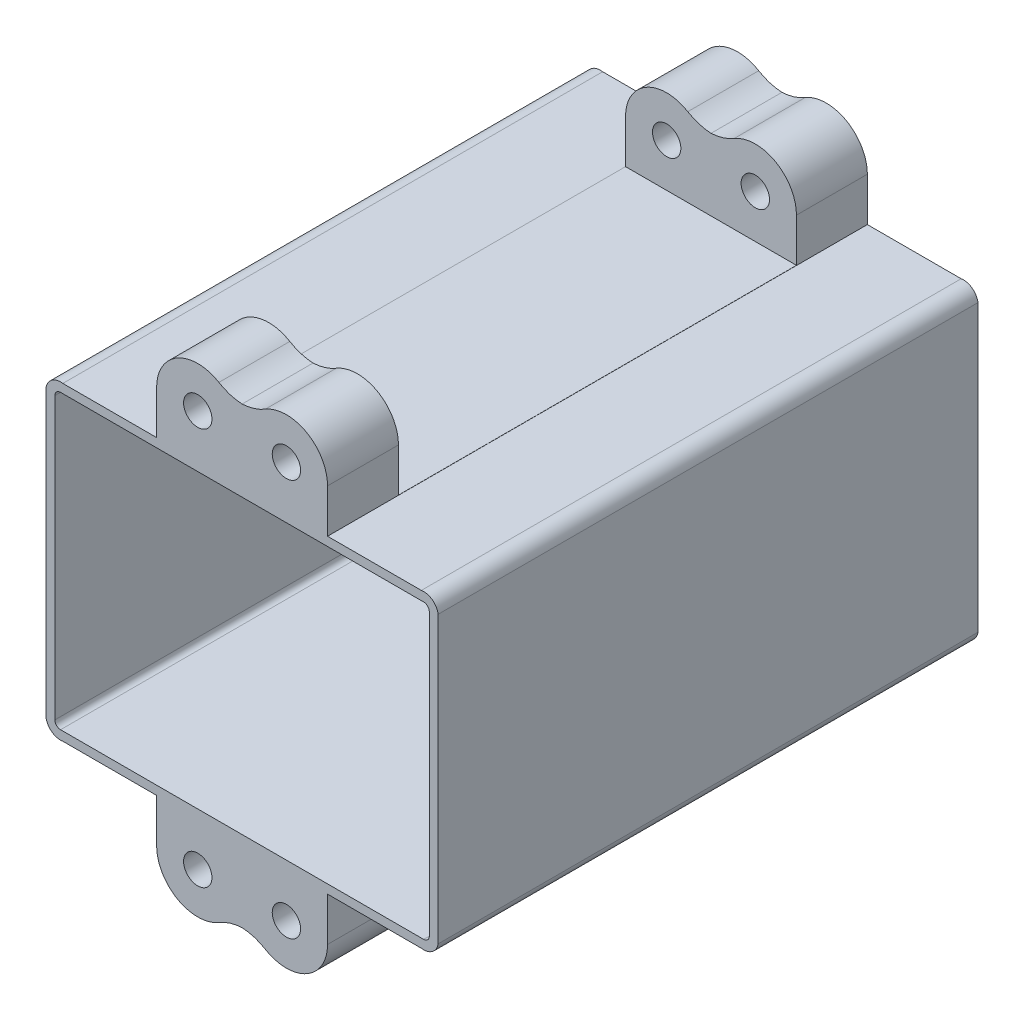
SolidWorks part; units mm, degrees
ref_plane "Front Plane" through (0, 0, 0) normal (0, 0, 1) x (1, 0, 0)
ref_plane "Top Plane" through (0, 0, 0) normal (0, 1, 0) x (1, 0, 0)
ref_plane "Right Plane" through (0, 0, 0) normal (1, 0, 0) x (0, 0, -1)
sketch "Sketch1" plane through (0, 0, 0) normal (0, 0, 1) x (1, 0, 0)
  line L0 (0, 19.8351) -> (0, -19.6651) construction
  line L1 (16.764, 13.081) -> (-16.764, 13.081) construction
  line L2 (-11.3179, 0) -> (13.0434, 0) construction
  line L3 (-17.5577, -12.7794) -> (-17.5577, 12.7794)
  line L4 (-16.764, 13.081) -> (-16.764, -13.1445) construction
  line L5 (-16.764, -12.573) -> (-16.764, 12.573)
  line L6 (-17.5577, 13.6263) -> (-17.5577, -13.6263) construction
  line L7 (16.764, -13.081) -> (16.764, 13.1445) construction
  line L8 (-9.2806, 17.78) -> (8.8312, 17.78) construction
  line L9 (-19.2317, 13.8747) -> (17.1582, 13.8747) construction
  line L10 (-7.6517, 13.8747) -> (-17.3621, 13.8747) construction
  line L11 (-7.6517, 17.78) -> (-7.6517, 13.8747)
  line L12 (9.2806, -17.78) -> (-8.8312, -17.78) construction
  line L13 (19.2317, -13.8747) -> (-17.1582, -13.8747) construction
  line L14 (-16.128, 13.8747) -> (-7.6517, 13.8747)
  line L15 (7.6517, 13.8747) -> (17.3621, 13.8747) construction
  line L16 (19.2317, 13.8747) -> (-17.1582, 13.8747) construction
  line L17 (9.2806, 17.78) -> (-8.8312, 17.78) construction
  line L18 (-16.256, 13.081) -> (16.256, 13.081)
  line L19 (17.5577, 13.6263) -> (17.5577, -13.6263) construction
  line L20 (16.764, 13.081) -> (16.764, -13.1445) construction
  line L21 (7.6517, -13.8747) -> (17.3621, -13.8747) construction
  line L22 (16.128, 13.8747) -> (7.6517, 13.8747)
  line L23 (-7.6517, -13.8747) -> (-17.3621, -13.8747) construction
  line L24 (7.6517, 17.78) -> (7.6517, 13.8747)
  line L25 (-19.2317, -13.8747) -> (17.1582, -13.8747) construction
  line L26 (16.764, -12.573) -> (16.764, 12.573)
  line L27 (17.5577, -12.7794) -> (17.5577, 12.7794)
  line L28 (-9.2806, -17.78) -> (8.8312, -17.78) construction
  line L29 (-16.764, -13.081) -> (-16.764, 13.1445) construction
  line L30 (16.764, -13.081) -> (-16.764, -13.081) construction
  line L31 (7.6517, -17.78) -> (7.6517, -13.8747)
  line L32 (16.128, -13.8747) -> (7.6517, -13.8747)
  line L33 (-16.256, -13.081) -> (16.256, -13.081)
  line L34 (-16.128, -13.8747) -> (-7.6517, -13.8747)
  line L35 (-7.6517, -17.78) -> (-7.6517, -13.8747)
  circle A0 centre (0, 0) radius 22.225 construction
  circle A1 centre (-3.9688, 17.78) radius 1.27
  circle A2 centre (3.9688, -17.78) radius 1.27
  arc A3 (-7.6517, 17.78) -> (-2.0777, 20.9404) centre (-3.9688, 17.78) cw
  arc A4 (7.6517, -17.78) -> (2.0777, -20.9404) centre (3.9688, -17.78) cw
  arc A5 (-2.0777, 20.9404) -> (2.5994, 20.9404) centre (0.2608, 24.8487) ccw
  arc A6 (-16.764, 12.573) -> (-16.256, 13.081) centre (-16.256, 12.573) cw
  arc A7 (-17.5577, 12.7794) -> (-16.0496, 13.8747) centre (-16.256, 12.573) cw
  arc A8 (2.0777, -20.9404) -> (-2.5994, -20.9404) centre (-0.2608, -24.8487) ccw
  arc A9 (16.764, -12.573) -> (16.256, -13.081) centre (16.256, -12.573) cw
  arc A10 (17.5577, -12.7794) -> (16.0496, -13.8747) centre (16.256, -12.573) cw
  arc A11 (-17.5577, -12.7794) -> (-16.0496, -13.8747) centre (-16.256, -12.573) ccw
  arc A12 (-16.764, -12.573) -> (-16.256, -13.081) centre (-16.256, -12.573) ccw
  arc A13 (-2.0777, -20.9404) -> (2.5994, -20.9404) centre (0.2608, -24.8487) cw
  arc A14 (17.5577, 12.7794) -> (16.0496, 13.8747) centre (16.256, 12.573) ccw
  arc A15 (16.764, 12.573) -> (16.256, 13.081) centre (16.256, 12.573) ccw
  arc A16 (2.0777, 20.9404) -> (-2.5994, 20.9404) centre (-0.2608, 24.8487) cw
  arc A17 (-7.6517, -17.78) -> (-2.0777, -20.9404) centre (-3.9688, -17.78) ccw
  arc A18 (7.6517, 17.78) -> (2.0777, 20.9404) centre (3.9688, 17.78) ccw
  circle A19 centre (-3.9688, -17.78) radius 1.27
  circle A20 centre (3.9688, 17.78) radius 1.27
  point P5 (0, 13.081)
  point P81 (0, 13.081)
  point P93 (0, -13.081)
  dimension "D1" = 44.45
  dimension "D5" = 2.54
  dimension "D6" = 17.78
  dimension "D10" = 0.7937
  dimension "D4" = 0.508
  dimension "D2" = 16.764
  dimension "D3" = 0.7937
  dimension "D7" = 3.9688
extrude "Extrude3" add sketch "Sketch1" along normal blind 48.3362
sketch "Sketch2" plane through (17.5577, 0, 0) normal (1, 0, 0) x (0, 0, -1)
  line L1 (0, 13.891) -> (-48.3362, 13.891) construction
  line L2 (-41.9862, 13.891) -> (-6.35, 13.891)
  line L3 (-41.9862, 13.891) -> (-41.9862, 22.9405)
  line L4 (-41.9862, 22.9405) -> (-6.35, 22.9405)
  line L7 (-51.1366, 0) -> (15.4249, 0) construction
  line L8 (-6.35, 13.891) -> (-6.35, 22.9405)
  line L9 (-6.35, -13.891) -> (-6.35, -22.9405)
  line L10 (-41.9862, -22.9405) -> (-6.35, -22.9405)
  line L11 (-41.9862, -13.891) -> (-41.9862, -22.9405)
  line L12 (-41.9862, -13.891) -> (-6.35, -13.891)
  dimension "D1" = 6.35
  dimension "D2" = 9.0495
  dimension "D3" = 6.35
extrude "Cut-Extrude2" cut sketch "Sketch2" against normal through all
